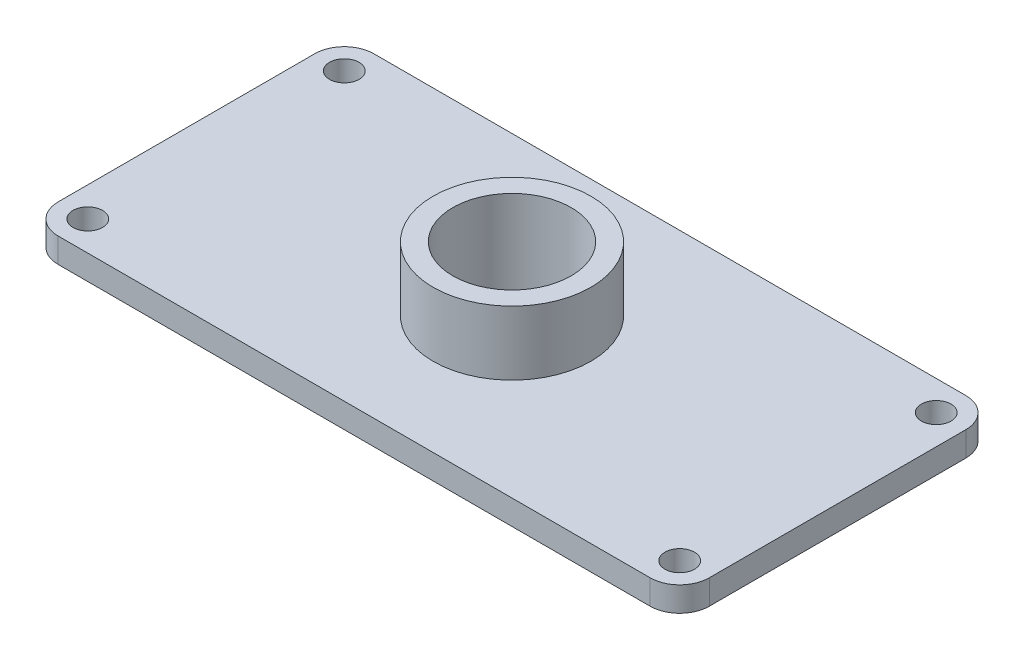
SolidWorks part; units mm, degrees
ref_plane "Front Plane" through (0, 0, 0) normal (0, 0, 1) x (1, 0, 0)
ref_plane "Top Plane" through (0, 0, 0) normal (0, 1, 0) x (1, 0, 0)
ref_plane "Right Plane" through (0, 0, 0) normal (1, 0, 0) x (0, 0, -1)
sketch "Sketch1" plane through (0, 0, 0) normal (0, 1, 0) x (1, 0, 0)
  line L1 (-60, -32) -> (60, -32)
  line L2 (-66, -26) -> (-66, 26)
  line L3 (-60, 32) -> (60, 32)
  line L4 (66, -26) -> (66, 26)
  circle A0 centre (0, 0) radius 12
  circle A1 centre (-60, 26) radius 3
  circle A2 centre (60, 26) radius 3
  circle A3 centre (60, -26) radius 3
  circle A4 centre (-60, -26) radius 3
  arc A5 (60, 32) -> (66, 26) centre (60, 26) cw
  arc A6 (66, -26) -> (60, -32) centre (60, -26) cw
  arc A7 (-60, -32) -> (-66, -26) centre (-60, -26) cw
  arc A8 (-66, 26) -> (-60, 32) centre (-60, 26) cw
  point P7 (-59.2958, -26)
  point P11 (60, 25.3064)
  point P13 (61.4665, -26)
  point P23 (0, 0)
  point P24 (-60, 25.1921)
  dimension "D2" = 24
  dimension "D6" = 6
  dimension "D7" = 6
  dimension "D8" = 6
  dimension "D9" = 6
  dimension "D10" = 6
  dimension "D1" = 66
  dimension "D3" = 32
  dimension "D4" = 64
  dimension "D5" = 132
extrude "Boss-Extrude1" add sketch "Sketch1" along normal blind 5
sketch "Sketch2" plane through (0, 5, 0) normal (0, 1, 0) x (1, 0, 0)
  circle A0 centre (0, 0) radius 12 construction
  circle A1 centre (0, 0) radius 12
  circle A2 centre (0, 0) radius 16
  dimension "D1" = 32
extrude "Boss-Extrude2" add sketch "Sketch2" along normal blind 13
